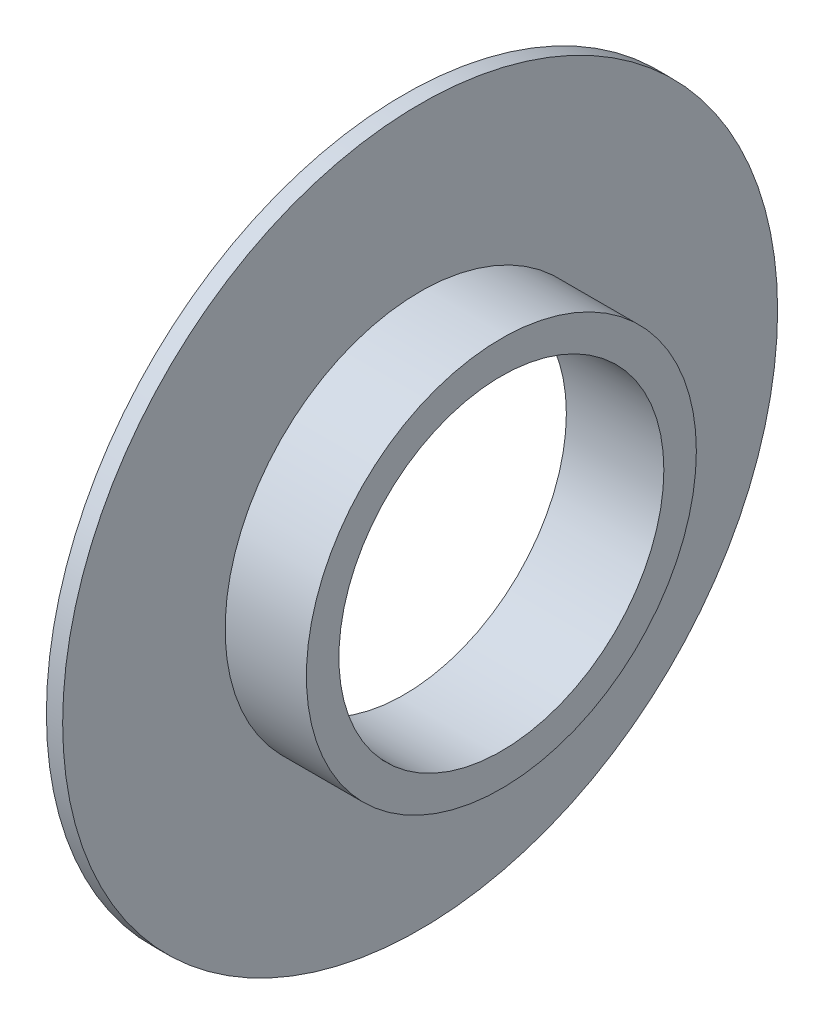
SolidWorks part; units mm, degrees
ref_plane "Plan de face" through (0, 0, 0) normal (0, 0, 1) x (1, 0, 0)
ref_plane "Plan de dessus" through (0, 0, 0) normal (0, 1, 0) x (1, 0, 0)
ref_plane "Plan de droite" through (0, 0, 0) normal (1, 0, 0) x (0, 0, -1)
sketch "Esquisse1" plane through (0, 0, 0) normal (0, 1, 0) x (1, 0, 0)
  line L0 (0, 0) -> (-10.2381, 0) construction
  line L1 (0, 6) -> (-2.5, 6)
  line L2 (0, 0) -> (0, 6)
  line L3 (-2.5, 6) -> (-2.5, 11)
  line L4 (-2.5, 11) -> (-3, 11)
  line L5 (-3, 11) -> (-3, 0)
  line L6 (-3, 0) -> (0, 0)
  dimension "D1" = 6
  dimension "D2" = 11
  dimension "D3" = 2.5
  dimension "D4" = 0.5
revolve "Révolution1" add sketch "Esquisse1" angle 360 about L0
sketch "Esquisse2" plane through (0, 0, 0) normal (1, 0, 0) x (0, 0, -1)
  circle A0 centre (0, 0) radius 5
  dimension "D1" = 10
extrude "Enlèv. mat.-Extru.1" cut sketch "Esquisse2" against normal through all
